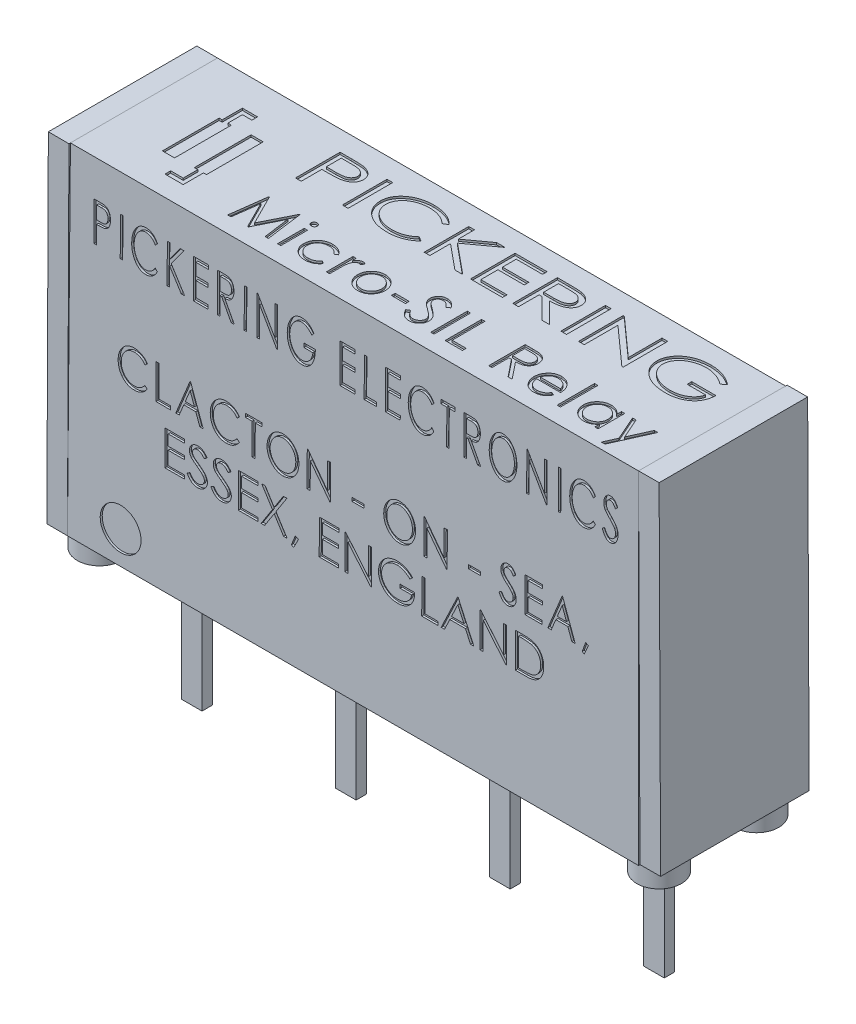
SolidWorks part; units mm, degrees
ref_plane "Front Plane" through (0, 0, 0) normal (0, 0, 1) x (1, 0, 0)
ref_plane "Top Plane" through (0, 0, 0) normal (0, 1, 0) x (1, 0, 0)
ref_plane "Right Plane" through (0, 0, 0) normal (1, 0, 0) x (0, 0, -1)
sketch "Sketch1" plane through (0, 0, 0) normal (0, 1, 0) x (1, 0, 0)
  line L1 (7.042, -1.85) -> (-7.042, -1.85)
  line L2 (7.042, -1.85) -> (7.042, 1.85)
  line L3 (7.042, 1.85) -> (-7.042, 1.85)
  line L4 (-7.042, -1.85) -> (-7.042, 1.85)
  line L5 (7.042, -1.85) -> (-7.042, 1.85) construction
  line L6 (7.042, 1.85) -> (-7.042, -1.85) construction
  point P0 (0, 0)
  dimension "D1" = 3.7
  dimension "D2" = 14.084
extrude "Main body" add sketch "Sketch1" along normal blind 8.392 draft 0.25
sketch "Sketch2" plane through (-7.0419, 0.0307, 0) normal (-1, 0.0044, 0) x (0, 0, 1)
  line L0 (-1.85, -0.0307) -> (1.85, -0.0307) construction
  line L1 (-1.8134, 8.3614) -> (1.85, 8.3614)
  line L2 (-1.8134, 8.3614) -> (-1.8134, -0.0307)
  line L3 (-1.8134, -0.0307) -> (1.85, -0.0307)
  line L4 (1.85, 8.3614) -> (1.85, -0.0307)
extrude "side 1" add sketch "Sketch2" along normal blind 0.508 separate body
sketch "Sketch3" plane through (7.0419, 0.0307, 0) normal (1, 0.0044, 0) x (0, 0, -1)
  line L0 (-1.85, -0.0307) -> (1.85, -0.0307) construction
  line L1 (-1.8134, 8.3614) -> (1.85, 8.3614)
  line L2 (-1.8134, 8.3614) -> (-1.8134, -0.0307)
  line L3 (-1.8134, -0.0307) -> (1.85, -0.0307)
  line L4 (1.85, 8.3614) -> (1.85, -0.0307)
extrude "side 2" add sketch "Sketch3" along normal blind 0.508 separate body
sketch "Sketch4" plane through (0, 0, 0) normal (0, -1, 0) x (1, 0, 0)
  line L3 (-7.042, 1.85) -> (7.042, 1.85) construction
  line L4 (-7.55, -1.8134) -> (-7.55, 1.85) construction
  line L5 (7.042, -1.85) -> (-7.042, -1.85) construction
  line L6 (7.55, 1.8134) -> (7.55, -1.85) construction
  circle A0 centre (-6.9, 1.2) radius 0.55
  circle A1 centre (-6.9, -1.2) radius 0.55
  circle A2 centre (6.9, 1.2) radius 0.55
  circle A3 centre (6.9, -1.2) radius 0.55
  dimension "D1" = 1.1
  dimension "D2" = 0.65
  dimension "D3" = 0.65
  dimension "D4" = 1.1
  dimension "D5" = 0.65
  dimension "D6" = 0.65
  dimension "D7" = 1.1
  dimension "D8" = 0.65
  dimension "D9" = 1.1
extrude "Feet" add sketch "Sketch4" along normal blind 0.508 separate body
sketch "Sketch5" plane through (0, 0, 0) normal (0, -1, 0) x (1, 0, 0)
  line L0 (7.55, 1.8134) -> (7.55, -1.85) construction
  line L1 (-5.446, -0.127) -> (-5.954, -0.127)
  line L2 (-5.446, -0.127) -> (-5.446, 0.127)
  line L3 (-5.446, 0.127) -> (-5.954, 0.127)
  line L4 (-5.954, -0.127) -> (-5.954, 0.127)
  line L5 (-5.446, -0.127) -> (-5.954, 0.127) construction
  line L6 (-5.446, 0.127) -> (-5.954, -0.127) construction
  line L7 (-1.646, -0.127) -> (-2.154, -0.127)
  line L8 (-1.646, -0.127) -> (-1.646, 0.127)
  line L9 (-1.646, 0.127) -> (-2.154, 0.127)
  line L10 (-2.154, -0.127) -> (-2.154, 0.127)
  line L11 (-1.646, -0.127) -> (-2.154, 0.127) construction
  line L12 (-1.646, 0.127) -> (-2.154, -0.127) construction
  line L13 (1.646, -0.127) -> (2.154, -0.127)
  line L14 (1.646, -0.127) -> (1.646, 0.127)
  line L15 (1.646, 0.127) -> (2.154, 0.127)
  line L16 (2.154, -0.127) -> (2.154, 0.127)
  line L17 (1.646, -0.127) -> (2.154, 0.127) construction
  line L18 (1.646, 0.127) -> (2.154, -0.127) construction
  line L19 (5.954, -0.127) -> (5.446, -0.127)
  line L20 (5.954, -0.127) -> (5.954, 0.127)
  line L21 (5.954, 0.127) -> (5.446, 0.127)
  line L22 (5.446, -0.127) -> (5.446, 0.127)
  line L23 (5.954, -0.127) -> (5.446, 0.127) construction
  line L24 (5.954, 0.127) -> (5.446, -0.127) construction
  point P0 (-5.7, 0)
  point P5 (-1.9, 0)
  point P10 (1.9, 0)
  point P16 (5.7, 0)
  dimension "D1" = 0.508
  dimension "D2" = 0.254
  dimension "D3" = 0.508
  dimension "D4" = 0.254
  dimension "D5" = 0.254
  dimension "D6" = 0.254
  dimension "D7" = 0.508
  dimension "D8" = 0.508
  dimension "D9" = 3.8
  dimension "D10" = 3.8
  dimension "D11" = 3.8
  dimension "D12" = 1.85
extrude "Pins" add sketch "Sketch5" along normal blind 3.808
sketch "Sketch7"
  dimension "D1" = 10.4
  dimension "D2" = 0.4
  dimension "D3" = 1.6
  dimension "D4" = 0.4
  dimension "D5" = 1
  dimension "D6" = 1.4
  dimension "D7" = 0.3
  dimension "D8" = 0.45
  dimension "D9" = 0.3
  dimension "D10" = 1.4
  dimension "D11" = 0.14
  dimension "D12" = 0.14
  dimension "D13" = 0.14
  dimension "D14" = 0.14
  dimension "D15" = 0.5
  dimension "D16" = 0.5
extrude "top face writing" cut sketch "Sketch7" against normal blind 0.05
sketch "Sketch8"
  dimension "D6" = 0.8
  dimension "D1" = 1.85
  dimension "D2" = 13.2
  dimension "D3" = 0.442
  dimension "D4" = 2.6
  dimension "D5" = 1.3
extrude "Address" cut sketch "Sketch8" against normal blind 0.05
sketch "Sketch9"
  dimension "D1" = 3
extrude "Relay type" add sketch "Sketch9" along normal blind 0.0001
